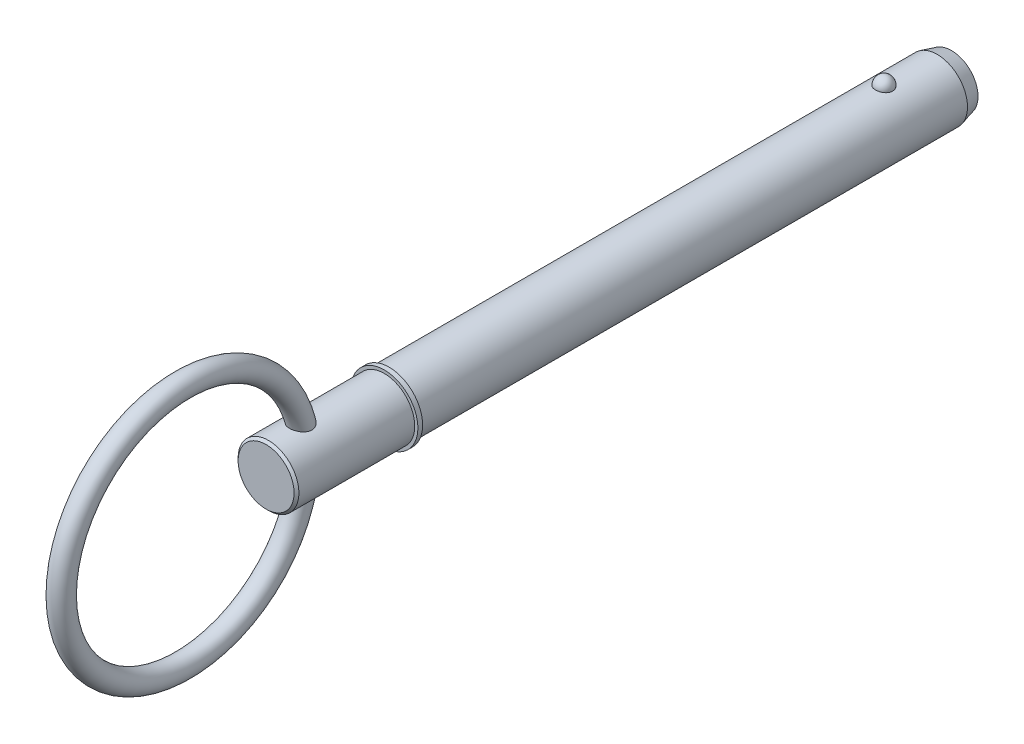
SolidWorks part; units mm, degrees
ref_plane "Front Plane" through (0, 0, 0) normal (0, 0, 1) x (1, 0, 0)
ref_plane "Top Plane" through (0, 0, 0) normal (0, 1, 0) x (1, 0, 0)
ref_plane "Right Plane" through (0, 0, 0) normal (1, 0, 0) x (0, 0, -1)
sketch "Sketch2" plane through (0, 0, 0) normal (0, 0, 1) x (1, 0, 0)
  circle A0 centre (0, 0) radius 6.35
  point P3 (0, 6.35)
  dimension "D1" = 12.7
extrude "Boss-Extrude1" add sketch "Sketch2" along normal blind 101.6
sketch "Sketch3" plane through (0, 0, 0) normal (0, 0, -1) x (-1, 0, 0)
  circle A0 centre (0, 0) radius 6.35
  dimension "D1" = 12.7
extrude "Boss-Extrude2" add sketch "Sketch3" along normal blind 15.88
chamfer "Chamfer1" distance 3 angle 15 1 edges at (-6.35, 0, -15.88)
sketch "Sketch18" plane through (0, 0, 0) normal (1, 0, 0) x (0, 0, -1)
  line L0 (12.88, 6.35) -> (-101.6, 6.35) construction
  line L1 (1.78, 8.13) -> (1.78, 4.57)
  line L2 (-101.6, -6.35) -> (12.88, -6.35) construction
  arc A0 (1.78, 8.13) -> (1.78, 4.57) centre (1.78, 6.35) ccw
  point P4 (0, 6.35)
  dimension "D1" = 14.48
revolve "Revolve1" add sketch "Sketch18" angle 360 about L1
sketch "Sketch19" plane through (0, 0, 0) normal (1, 0, 0) x (0, 0, -1)
  line L0 (-33.7288, 0) -> (-46.4542, 0) construction
sketch "Sketch20" plane through (0, 0, 0) normal (1, 0, 0) x (0, 0, -1)
  line L0 (-101.6, 0) -> (-101.6, 7)
  line L1 (-101.6, 6.35) -> (-101.6, -6.35) construction
  line L2 (-101.6, 7) -> (-102.6, 7)
  line L3 (-102.6, 7) -> (-102.6, 0)
  line L4 (-33.7288, 0) -> (-46.4542, 0) construction
  line L5 (-102.6, 0) -> (-101.6, 0)
  dimension "D1" = 7
  dimension "D2" = 1
revolve "Revolve2" add sketch "Sketch20" angle 360 about L0
sketch "Sketch21" plane through (0, 0, 101.6) normal (0, 0, -1) x (-1, 0, 0)
  circle A0 centre (0, 0) radius 6.35
  dimension "D1" = 12.7
extrude "Boss-Extrude3" add sketch "Sketch21" against normal blind 25.7
chamfer "Chamfer2" distance 0.5 angle 45 1 edges at (-6.35, 0, 127.3)
sketch "Sketch23" plane through (0, 0, 0) normal (1, 0, 0) x (0, 0, -1)
  line L0 (-127.3, 5.85) -> (-127.3, -5.85) construction
  circle A0 centre (-144.7, 0) radius 25.4
  point P2 (-119.3, 0)
  dimension "D1" = 50.8
  dimension "D2" = 8
sketch "Sketch24" plane through (0, 0, 0) normal (0, 1, 0) x (1, 0, 0)
  circle A0 centre (0, -119.3) radius 2.25
  dimension "D1" = 4.5
sweep "Sweep1" add profiles "Sketch24" path "Sketch23"
